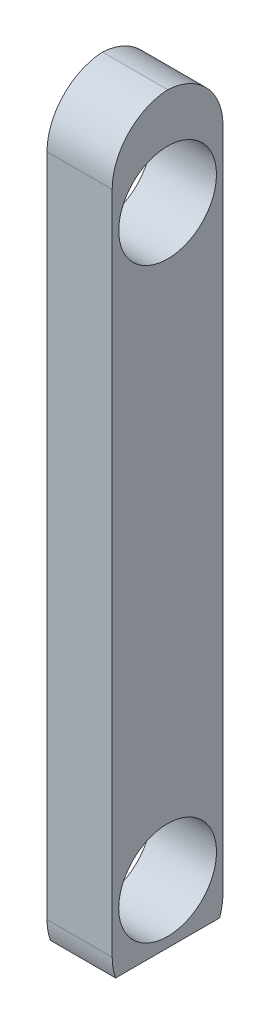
SolidWorks part; units mm, degrees
ref_plane "Front Plane" through (0, 0, 0) normal (0, 0, 1) x (1, 0, 0)
ref_plane "Top Plane" through (0, 0, 0) normal (0, 1, 0) x (1, 0, 0)
ref_plane "Right Plane" through (0, 0, 0) normal (1, 0, 0) x (0, 0, -1)
sketch "Sketch2" plane through (0, 0, 0) normal (1, 0, 0) x (0, 0, -1)
  line L0 (3.7022, 0) -> (7.1022, 0)
  line L1 (7.1022, 0) -> (7.1022, -24)
  line L2 (7.1022, -24) -> (3.7022, -24)
  line L3 (3.7022, -24) -> (3.7022, 0)
  dimension "28" = 24
  dimension "D2" = 3.4
extrude "Boss-Extrude1" add sketch "Sketch2" along normal blind 2
sketch "Sketch3" plane through (2, 0, 0) normal (1, 0, 0) x (0, 0, -1)
  line L0 (5.4022, 0) -> (5.4022, -24) construction
  line L1 (7.1022, 0) -> (3.7022, 0) construction
  line L2 (3.7022, -24) -> (7.1022, -24) construction
  line L3 (3.7022, 0) -> (3.7022, -3) construction
  line L4 (3.7022, 0) -> (3.7022, -24) construction
  line L5 (3.7022, -3) -> (5.4022, -3) construction
  line L6 (3.7022, -12) -> (7.1022, -12) construction
  line L7 (7.1022, -24) -> (7.1022, 0) construction
  circle A0 centre (5.4022, -3) radius 1.5
  circle A1 centre (5.4022, -21) radius 1.5
  dimension "D2" = 3
  dimension "D1" = 3
extrude "Cut-Extrude1" cut sketch "Sketch3" against normal blind 2
fillet "Fillet1" radius 1.8 4 edges at (1, -24, -7.1022) (1, -24, -3.7022) (1, 0, -3.7022) (1, 0, -7.1022)
sketch "Sketch4" plane through (2, 0, 0) normal (1, 0, 0) x (0, 0, -1)
  line L0 (3.8068, -22.8048) -> (6.9976, -22.8048)
  line L1 (6.9976, -22.8048) -> (6.9976, -24.4807)
  line L2 (6.9976, -24.4807) -> (3.8068, -24.4807)
  line L3 (3.8068, -24.4807) -> (3.8068, -22.8048)
  arc A0 (3.7022, -22.2) -> (5.4022, -23.9972) centre (5.5022, -22.2) ccw construction
  arc A1 (5.4022, -23.9972) -> (7.1022, -22.2) centre (5.3022, -22.2) ccw construction
extrude "Cut-Extrude2" cut sketch "Sketch4" against normal through all
